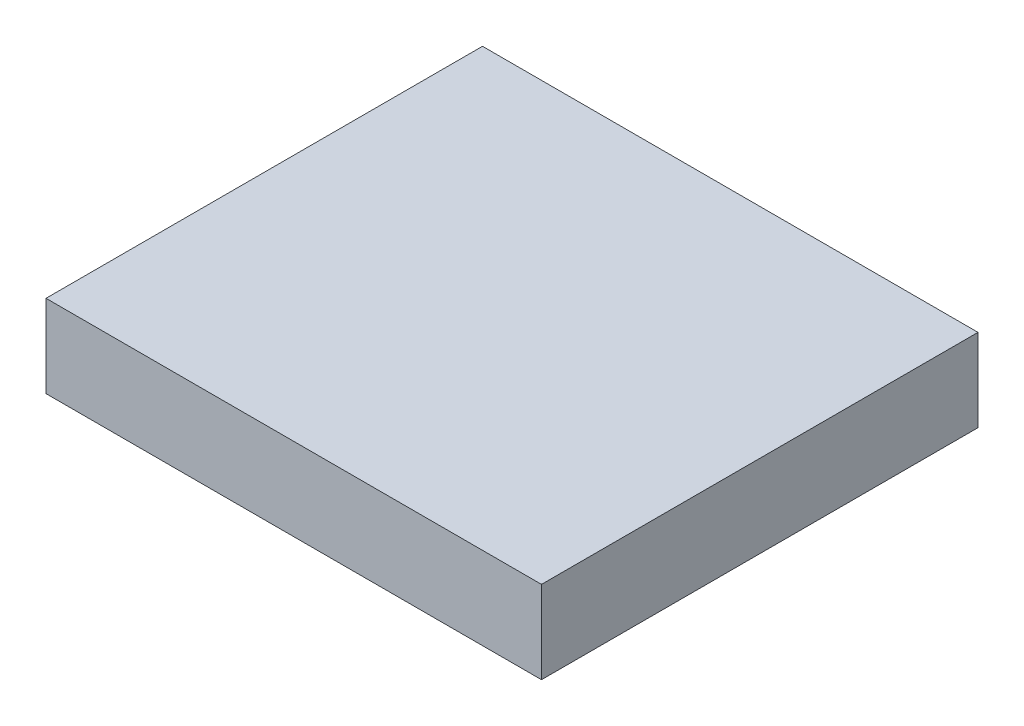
SolidWorks part; units mm, degrees
ref_plane "Front Plane" through (0, 0, 0) normal (0, 0, 1) x (1, 0, 0)
ref_plane "Top Plane" through (0, 0, 0) normal (0, 1, 0) x (1, 0, 0)
ref_plane "Right Plane" through (0, 0, 0) normal (1, 0, 0) x (0, 0, -1)
body saved out of another part "Stock-Part1-1"
sketch "Sketch1" plane through (0, 1000, 0) normal (0, -1, 0) x (1, 0, 0)
  line L0 (677.9364, 175) -> (677.9364, -175)
  line L5 (677.9364, -175) -> (1127.9364, -175)
  line L6 (1127.9364, 175) -> (1127.9364, -175)
  line L7 (677.9364, 175) -> (1127.9364, 175)
extrude "Cut-Extrude1" cut sketch "Sketch1" against normal blind 60
sketch "Sketch2" plane through (1112.9364, 0, 0) normal (1, 0, 0) x (0, 0, -1)
  line L0 (185, 1070) -> (185, 1000) construction
  line L1 (185, 1070) -> (-185, 1070) construction
  line L2 (-185, 1070) -> (-185, 1000) construction
  line L3 (185, 1070) -> (185, 1000)
  line L4 (185, 1070) -> (-185, 1070)
  line L5 (-185, 1070) -> (-185, 1000)
  line L6 (-185, 1000) -> (185, 1000)
extrude "Boss-Extrude1" add sketch "Sketch2" against normal blind 10
sketch "Sketch4" plane through (692.9364, 0, 0) normal (-1, 0, 0) x (0, 0, 1)
  line L0 (-185, 1070) -> (-185, 1000) construction
  line L1 (185, 1070) -> (-185, 1070) construction
  line L2 (185, 1070) -> (185, 1000) construction
  line L3 (-185, 1070) -> (-185, 1000)
  line L4 (185, 1070) -> (-185, 1070)
  line L5 (185, 1070) -> (185, 1000)
  line L6 (185, 1000) -> (-185, 1000)
extrude "Boss-Extrude2" add sketch "Sketch4" against normal blind 10
